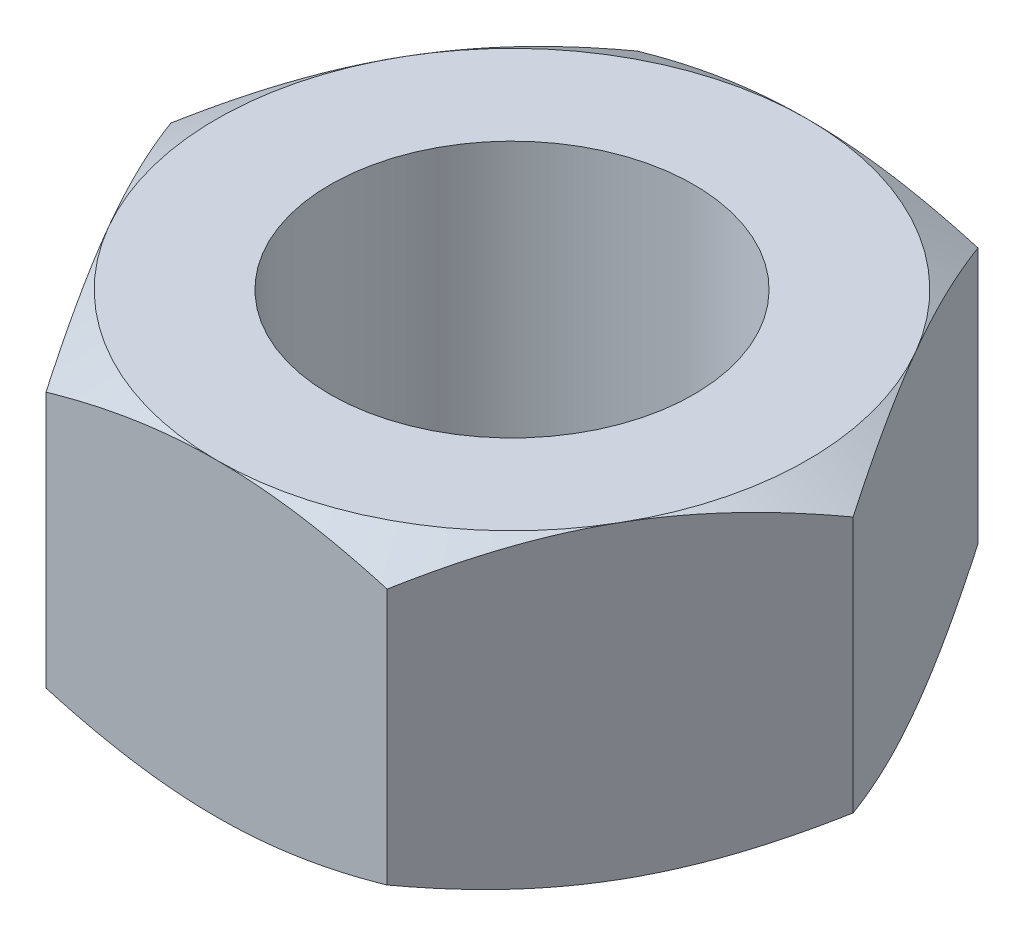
SolidWorks part; units mm, degrees
ref_plane "Front Plane" through (0, 0, 0) normal (0, 0, 1) x (1, 0, 0)
ref_plane "Top Plane" through (0, 0, 0) normal (0, 1, 0) x (1, 0, 0)
ref_plane "Right Plane" through (0, 0, 0) normal (1, 0, 0) x (0, 0, -1)
sketch "Sketch1" plane through (0, 0, 0) normal (0, 1, 0) x (1, 0, 0)
  line L1 (7.5056, 0) -> (3.7528, 6.5)
  line L2 (3.7528, 6.5) -> (-3.7528, 6.5)
  line L3 (-3.7528, 6.5) -> (-7.5056, 0)
  line L4 (-7.5056, 0) -> (-3.7528, -6.5)
  line L5 (-3.7528, -6.5) -> (3.7528, -6.5)
  line L6 (3.7528, -6.5) -> (7.5056, 0)
  circle A0 centre (0, 0) radius 6.5 construction
  dimension "D1" = 13
extrude "Boss-Extrude1" add sketch "Sketch1" along normal mid plane 6.8
sketch "Sketch2" plane through (0, 3.4, 0) normal (0, 1, 0) x (1, 0, 0)
  line L0 (-7.5056, 0) -> (-3.7528, -6.5) construction
  circle A0 centre (0, 0) radius 6.5
extrude "Cut-Extrude1" cut sketch "Sketch2" against normal blind 6.8 draft 60 flip side to cut
mirror "Mirror1" about plane through (0, 0, 0) normal (0, 1, 0) of "Cut-Extrude1"
sketch "Sketch3" plane through (0, 3.4, 0) normal (0, 1, 0) x (1, 0, 0)
  circle A0 centre (0, 0) radius 4
  dimension "D1" = 8
extrude "Cut-Extrude2" cut sketch "Sketch3" against normal blind 6.8
